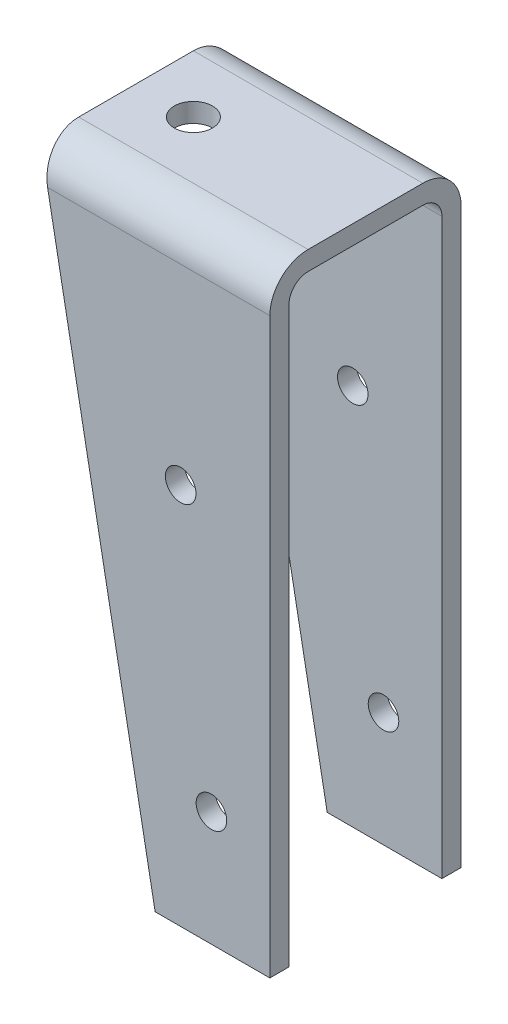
SolidWorks part; units mm, degrees
ref_plane "Plan1" through (0, 0, 0) normal (0, 0, 1) x (1, 0, 0)
ref_plane "Plan2" through (0, 0, 0) normal (0, 1, 0) x (1, 0, 0)
ref_plane "Plan3" through (0, 0, 0) normal (1, 0, 0) x (0, 0, -1)
sketch "Esquisse1" plane through (0, 0, 0) normal (0, 0, 1) x (1, 0, 0)
  line L0 (0, 0) -> (0, 160)
  line L1 (0, 160) -> (-60, 160)
  line L2 (-60, 160) -> (-30, 0)
  line L3 (-30, 0) -> (0, 0)
  dimension "D1" = 160
  dimension "D2" = 30
  dimension "D3" = 60
extrude "Extrusion1" add sketch "Esquisse1" along normal blind 50
sketch "Esquisse2" plane through (0, 0, 0) normal (1, 0, 0) x (0, 0, -1)
  line L0 (-50, 0) -> (0, 0) construction
  line L1 (-5, 0) -> (-45, 0)
  line L2 (-5, 0) -> (-5, 155)
  line L3 (-5, 155) -> (-45, 155)
  line L4 (-45, 0) -> (-45, 155)
  line L5 (0, 0) -> (0, 160) construction
  line L6 (-50, 0) -> (-50, 160) construction
  line L7 (-50, 160) -> (0, 160) construction
  dimension "D1" = 5
  dimension "D2" = 5
  dimension "D3" = 5
extrude "Enlèv. mat.-Extru.1" cut sketch "Esquisse2" against normal through all
fillet "Congé2" radius 5 2 edges at (-29.5312, 155, 5) (-29.5312, 155, 45)
fillet "Congé3" radius 10 2 edges at (-30, 160, 0) (-30, 160, 50)
sketch "Esquisse3" plane through (0, 0, 50) normal (0, 0, 1) x (1, 0, 0)
  line L0 (-58.125, 150) -> (-30, 0) construction
  line L1 (-60, 160) -> (0, 160) construction
  circle A0 centre (-23.3143, 100) radius 4
  circle A1 centre (-15.2765, 30) radius 4
  dimension "D1" = 8
  dimension "D2" = 8
  dimension "D3" = 20
  dimension "D4" = 25
  dimension "D5" = 70
  dimension "D6" = 60
extrude "Enlèv. mat.-Extru.2" cut sketch "Esquisse3" against normal through all
hole_wizard "Trou taraudé M10x1.51" positions "Esquisse5" profile "Esquisse4" tap size "M10x1.5" standard "ISO"
sketch "Esquisse5" plane through (0, 160, 0) normal (0, 1, 0) x (-1, 0, 0)
  line L0 (60, 40) -> (60, 10) construction
  line L1 (30, 50) -> (0, 50) construction
  point P0 (45, 25)
  dimension "D1" = 15
  dimension "D2" = 25
sketch "Esquisse4" plane through (-45, 160, 25) normal (1, 0, 0) x (0, 0, 1)
  line L0 (0, 0) -> (0, 160)
  line L1 (0, 160) -> (4.25, 160)
  line L3 (4.25, 160) -> (4.25, 20)
  line L4 (4.25, 20) -> (5, 20)
  line L5 (5, 20) -> (5, 0)
  line L7 (5, 0) -> (0, 0)
  line L11 (0, -6.35) -> (0, 107.95) construction
  dimension "Diamètre du trou pour taraudage jusqu'au prochain" = 8.5
  dimension "Profondeur du trou pour taraudage jusqu'au prochain" = 160
  dimension "Diamètre principal du filetage" = 10
  dimension "Profondeur du filetage" = 20
